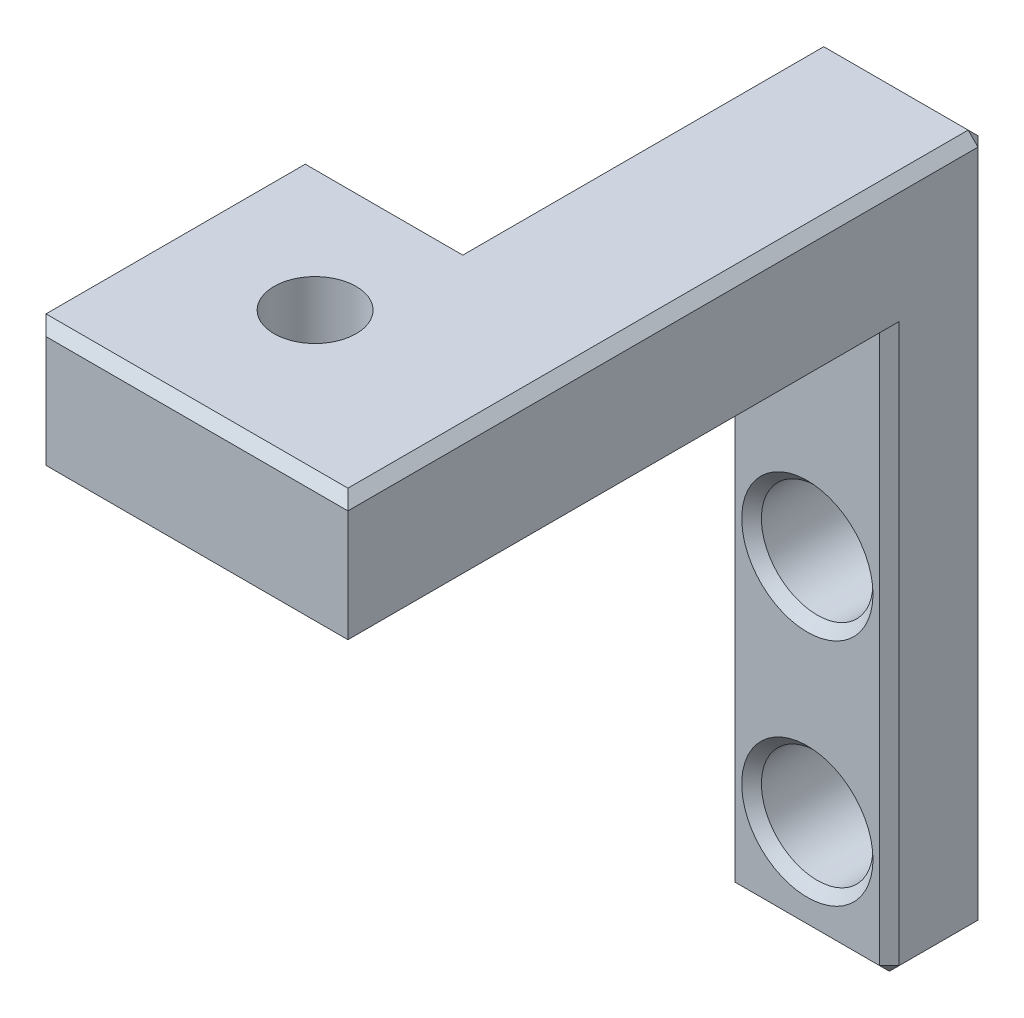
SolidWorks part; units mm, degrees
ref_plane "前视基准面" through (0, 0, 0) normal (0, 0, 1) x (1, 0, 0)
ref_plane "上视基准面" through (0, 0, 0) normal (0, 1, 0) x (1, 0, 0)
ref_plane "右视基准面" through (0, 0, 0) normal (1, 0, 0) x (0, 0, -1)
other "Configuration Table"
sketch "草图1" plane through (0, 0, 0) normal (0, 0, 1) x (1, 0, 0)
  line L1 (-2.5, 10.5) -> (2.5, 10.5)
  line L2 (-2.5, 10.5) -> (-2.5, -10.5)
  line L3 (-2.5, -10.5) -> (2.5, -10.5)
  line L4 (2.5, 10.5) -> (2.5, -10.5)
  line L5 (-2.5, 10.5) -> (2.5, -10.5) construction
  line L6 (-2.5, -10.5) -> (2.5, 10.5) construction
  point P0 (0, 0)
  dimension "D1" = 21
  dimension "D2" = 5
extrude "凸台-拉伸1" add sketch "草图1" along normal blind 3
sketch "草图2" plane through (0, 0, 3) normal (0, 0, 1) x (1, 0, 0)
  line L0 (2.5, -10.5) -> (2.5, 10.5) construction
  line L1 (-2.5, 10.5) -> (2.5, 10.5)
  line L2 (-2.5, 10.5) -> (-2.5, 6.5)
  line L3 (-2.5, 6.5) -> (2.5, 6.5)
  line L4 (2.5, 10.5) -> (2.5, 6.5)
  dimension "D1" = 4
extrude "凸台-拉伸2" add sketch "草图2" along normal blind 8
sketch "草图3" plane through (0, 0, 11) normal (0, 0, 1) x (1, 0, 0)
  line L1 (2.5, 10.5) -> (-7, 10.5)
  line L2 (2.5, 10.5) -> (2.5, 6.5)
  line L3 (2.5, 6.5) -> (-7, 6.5)
  line L4 (-7, 10.5) -> (-7, 6.5)
  dimension "D1" = 9.5
  dimension "D2" = 4
extrude "凸台-拉伸3" add sketch "草图3" along normal blind 8.5
sketch "草图4" plane through (0, 0, 3) normal (0, 0, 1) x (1, 0, 0)
  line L0 (2.5, -10.5) -> (2.5, 6.5) construction
  line L1 (-2.5, -10.5) -> (2.5, -10.5) construction
  circle A0 centre (0, -0.5) radius 1.7
  circle A1 centre (0, -7.5) radius 1.7
  point P4 (0, 0)
  dimension "D4" = 3.4
  dimension "D1" = 2.5
  dimension "D2" = 3
  dimension "D3" = 7
extrude "切除-拉伸1" cut sketch "草图4" against normal blind 8.5
hole_wizard "M3 螺纹孔1" positions "草图7" profile "草图6" tap size "M3" standard "GB"
sketch "草图7" plane through (0, 6.5, 0) normal (0, -1, 0) x (-1, 0, 0)
  line L0 (7, -19.5) -> (7, -11) construction
  line L1 (7, -19.5) -> (-2.5, -19.5) construction
  point P0 (3, -15)
  dimension "D1" = 4
  dimension "D2" = 4.5
sketch "草图6" plane through (-3, 6.5, 15) normal (1, 0, 0) x (0, 0, -1)
  line L0 (0, 0) -> (0, 4)
  line L1 (0, 4) -> (1.25, 4)
  line L2 (1.25, 4) -> (1.25, 0)
  line L5 (1.25, 0) -> (0, 0)
  line L11 (0, -6.35) -> (0, 107.95) construction
  dimension "通孔螺纹孔钻头直径" = 2.5
  dimension "通孔螺纹孔钻头深度" = 4
chamfer "倒角1" distance 0.3 angle 45 11 edges at (2.5, 0, 0) (0, -10.5, 0) (2.5, -2, 3) (-2.5, -2, 3) (2.5, -10.5, 1.5) (0, -10.5, 3) (-2.5, -10.5, 1.5) (-2.5, 0, 0) (-2.5, 10.5, 5.5) (0, 10.5, 0) (2.5, 10.5, 9.75)
chamfer "倒角2" distance 0.3 angle 45 13 edges at (1.7, -7.5, 0) (1.7, -0.5, 0) (1.7, -7.5, 3) (1.7, -0.5, 3) (-4.6, 10.5, 11) (-2.4, 10.5, 19.5) (-7, 8.5, 19.5) (-7, 8.5, 11) (-2.5, 6.5, 6.85) (-4.75, 6.5, 11) (-7, 6.5, 15.25) (-2.25, 6.5, 19.5) (2.5, 6.5, 11.1)
